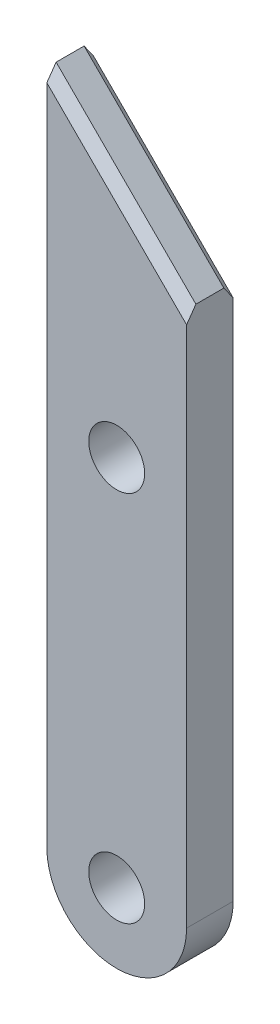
SolidWorks part; units mm, degrees
ref_plane "Face" through (0, 0, 0) normal (0, 0, 1) x (1, 0, 0)
ref_plane "Dessus" through (0, 0, 0) normal (0, 1, 0) x (1, 0, 0)
ref_plane "Droite" through (0, 0, 0) normal (1, 0, 0) x (0, 0, -1)
sketch "Esquisse1" plane through (0, 0, 0) normal (0, 0, 1) x (1, 0, 0)
  line L0 (0, 0) -> (30, -30)
  line L2 (0, 0) -> (0, -145)
  line L4 (30, -30) -> (30, -145)
  arc A0 (0, -145) -> (30, -145) centre (15, -145) ccw
extrude "Extrusion1" add sketch "Esquisse1" along normal blind 10
sketch "Esquisse2" plane through (0, 0, 10) normal (0, 0, 1) x (1, 0, 0)
  circle A0 centre (15, -145) radius 6
  circle A1 centre (15, -65) radius 6
  dimension "D1" = 80
extrude "Enlèv. mat.-Extru.1" cut sketch "Esquisse2" against normal blind 10
chamfer "Chanfrein1" distance 2 angle 45 2 edges at (15, -15, 0) (15, -15, 10)
